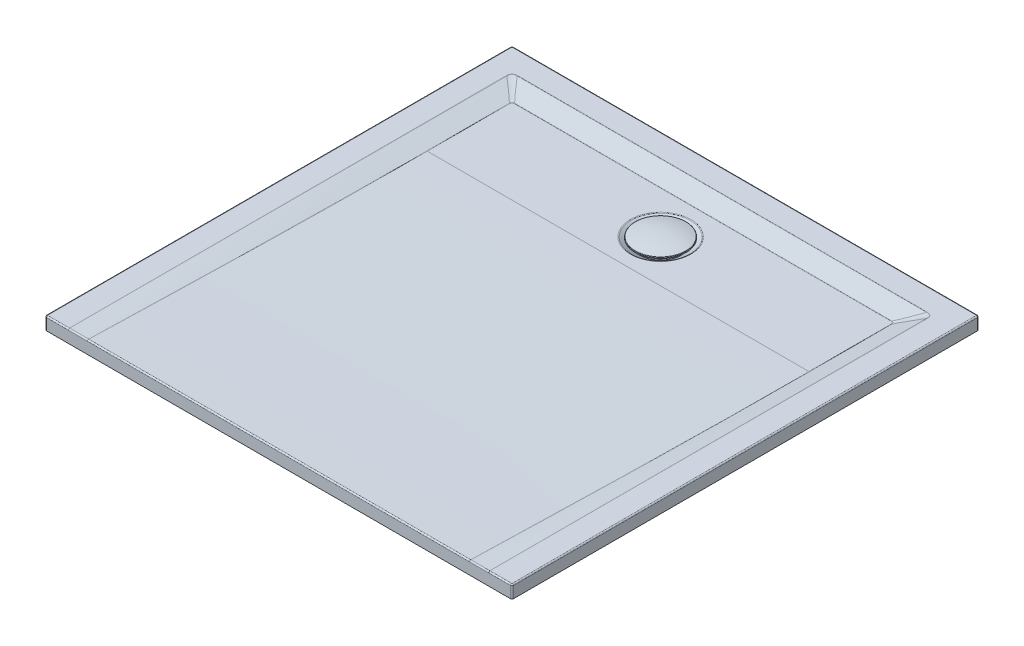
SolidWorks part; units mm, degrees
ref_plane "Płaszczyzna przednia" through (0, 0, 0) normal (0, 0, 1) x (1, 0, 0)
ref_plane "Płaszczyzna górna" through (0, 0, 0) normal (0, 1, 0) x (1, 0, 0)
ref_plane "Płaszczyzna prawa" through (0, 0, 0) normal (1, 0, 0) x (0, 0, -1)
sketch "Szkic1" plane through (0, 0, 0) normal (0, 1, 0) x (1, 0, 0)
  line L0 (0, 550) -> (0, -550) construction
  line L1 (-550, 550) -> (550, 550)
  line L2 (-550, 550) -> (-550, -550)
  line L3 (-550, -550) -> (550, -550)
  line L4 (550, 550) -> (550, -550)
  line L5 (-495, -550) -> (-495, 495)
  line L6 (-495, 495) -> (495, 495)
  line L7 (495, 495) -> (495, -550)
  line L8 (-450, -550) -> (-450, 450)
  line L9 (-450, 450) -> (450, 450)
  line L10 (450, 450) -> (450, -550)
  circle A0 centre (0, 350) radius 45
  circle A1 centre (0, 350) radius 70
  point P9 (0, 495)
  dimension "D6" = 90
  dimension "D7" = 140
  dimension "D1" = 1100
  dimension "D2" = 55
  dimension "D3" = 55
  dimension "D5" = 200
  dimension "D8" = 1100
  dimension "D4" = 45
sketch "Szkic2" plane through (0, 0, 0) normal (0, 1, 0) x (1, 0, 0)
  line L0 (-550, -550) -> (550, -550) construction
  line L1 (550, 550) -> (550, -550) construction
  line L2 (495, 495) -> (495, -550) construction
  line L3 (-495, 495) -> (495, 495) construction
  line L4 (-550, 550) -> (550, 550) construction
  line L5 (-495, -550) -> (-495, 495) construction
  line L6 (-550, 550) -> (-550, -550) construction
  line L7 (-550, -550) -> (-495, -550)
  line L8 (550, 550) -> (550, -550)
  line L9 (495, 495) -> (495, -550)
  line L10 (-495, 495) -> (495, 495)
  line L11 (-550, 550) -> (550, 550)
  line L12 (-495, -550) -> (-495, 495)
  line L13 (-550, 550) -> (-550, -550)
  line L14 (495, -550) -> (550, -550)
surface "Powierzchnia-Płaszczyzna1" sketch "Szkic2"
ref_plane "Płaszczyzna1" through (0, -15, 0) normal (0, 1, 0) x (-1, 0, 0)
sketch "Szkic3" plane through (0, -15, 0) normal (0, 1, 0) x (-1, 0, 0)
  line L0 (450, -250) -> (-450, -250)
  line L1 (450, 550) -> (450, -450) construction
  line L2 (-450, -450) -> (-450, 550) construction
  line L3 (0, -250) -> (0, -450) construction
  line L4 (450, -450) -> (-450, -450) construction
  line L5 (-450, -450) -> (-450, -250)
  line L6 (450, -250) -> (450, -450)
  line L7 (450, -450) -> (-450, -450)
  circle A0 centre (0, -350) radius 70 construction
  circle A1 centre (0, -350) radius 70
  point P10 (0, -350)
surface "Powierzchnia-Płaszczyzna2" sketch "Szkic3"
sketch "Szkic4" plane through (0, 0, 0) normal (0, 1, 0) x (1, 0, 0)
  line L0 (450, -550) -> (-450, -550)
other "Granica-Powierzchnia1"
other "Granica-Powierzchnia2"
other "Granica-Powierzchnia3"
mirror "Lustro1" about plane through (0, 0, 0) normal (1, 0, 0)
sketch "Szkic5" plane through (0, 0, 0) normal (0, 1, 0) x (1, 0, 0)
  line L0 (550, 550) -> (550, -550) construction
  line L1 (-550, 550) -> (550, 550) construction
  line L2 (-550, 550) -> (-550, -550) construction
  line L3 (-550, -550) -> (550, -550) construction
  line L4 (550, 550) -> (550, -550)
  line L5 (-550, 550) -> (550, 550)
  line L6 (-550, 550) -> (-550, -550)
  line L7 (-550, -550) -> (550, -550)
surface "Powierzchnia-Wyciągnięcie1" sketch "Szkic5" parameters "D1"=30
sketch "Szkic7" plane through (0, 0, 0) normal (1, 0, 0) x (0, 0, -1)
  line L0 (350, 0) -> (350, -30) construction
  line L1 (550, -30) -> (-550, -30) construction
  line L2 (395, -30) -> (395, -28)
  line L3 (395, -28) -> (399, -28)
  line L6 (399, -28) -> (420, -15)
  dimension "D1" = 90
  dimension "D2" = 2
  dimension "D3" = 98
surface "Powierzchnia-Obrót wokół linii środkowej1" sketch "Szkic7" parameters "D1"=360
surface "Powierzchnia-Płaszczyzna3"
surface "Powierzchnia-Połącz1"
fillet "Zaokrąglenie1" radius 4 6 edges at (0, -28, -399) (0, -15, -280) (550, -15, 550) (550, -15, -550) (-550, -15, -550) (-550, -15, 550)
fillet "Zmienne zaokrąglenie1" radius 40 2 edges at (472.5, -7.5, -472.5)
fillet "Zaokrąglenie3" radius 3 12 edges
fillet "Zaokrąglenie4" radius 3 12 edges at (-548.8284, 0, -548.8284) (0, 0, -550) (548.8284, 0, -548.8284) (550, 0, 0) (548.8284, 0, 548.8284) (520.5, 0, 550) (-520.5, 0, 550) (-548.8284, 0, 548.8284) (-550, 0, 0)
sketch "Szkic8" plane through (0, 0, 0) normal (1, 0, 0) x (0, 0, -1)
  line L0 (350, 0) -> (350, -30) construction
  line L1 (350, -5.6601) -> (179.8469, -5.6601) construction
  line L2 (410, -14.7573) -> (410, -17)
  line L3 (410, -17) -> (350, -17)
  line L4 (350, -17) -> (350, -5.6601)
  line L5 (350, -5.6601) -> (199.9922, 95.6514)
  arc A0 (350, -5.6601) -> (409.2694, -13.7943) centre (350, -225.6601) cw
  arc A1 (409.2694, -13.7943) -> (410, -14.7573) centre (409, -14.7573) cw
  point P11 (410, -14)
  dimension "D1" = 220
  dimension "D4" = 1
  dimension "D2" = 60
  dimension "D3" = 3
  dimension "D5" = 13
revolve "Obrót wokół linii środkowej1" add sketch "Szkic8" angle 360 about L4
